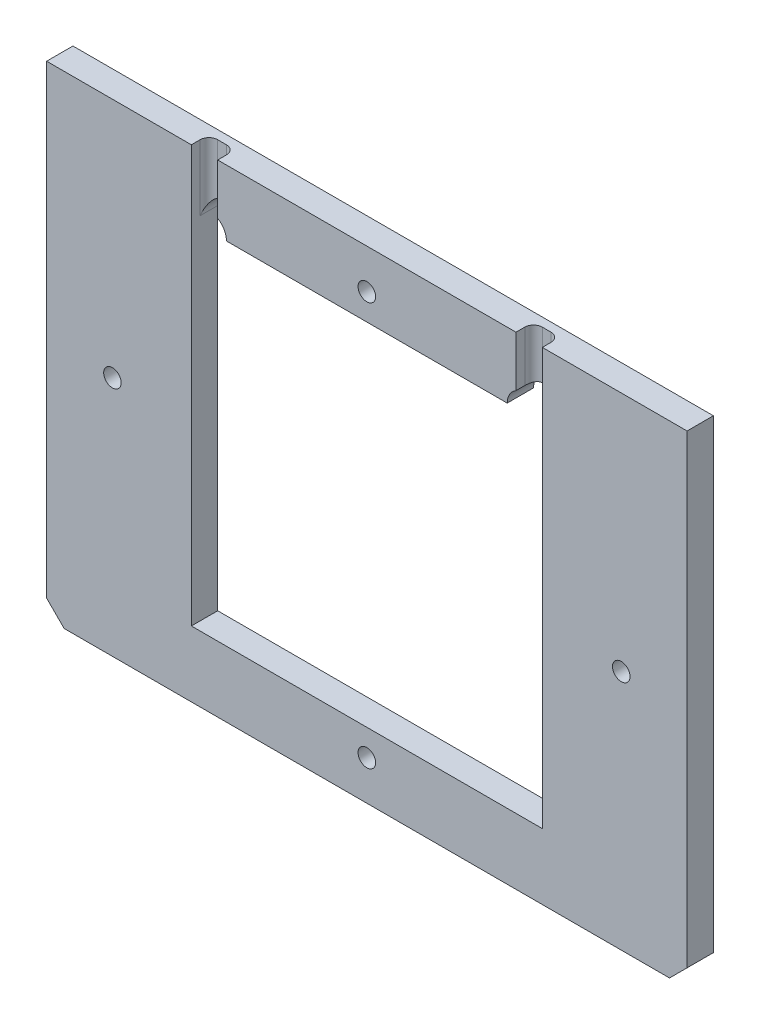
SolidWorks part; units mm, degrees
ref_plane "Face" through (0, 0, 0) normal (0, 0, 1) x (1, 0, 0)
ref_plane "Dessus" through (0, 0, 0) normal (0, 1, 0) x (1, 0, 0)
ref_plane "Droite" through (0, 0, 0) normal (1, 0, 0) x (0, 0, -1)
sketch "Esquisse1" plane through (0, 0, 0) normal (0, 0, 1) x (1, 0, 0)
  line L0 (-14.2779, 33.0997) -> (-14.2779, -21.9003) construction
  line L1 (-50.7779, 33.0997) -> (22.2221, 33.0997)
  line L2 (-50.7779, 33.0997) -> (-50.7779, -21.9003)
  line L3 (-50.7779, -21.9003) -> (22.2221, -21.9003)
  line L4 (22.2221, 33.0997) -> (22.2221, -21.9003)
  line L5 (-30.2779, 25.5997) -> (1.7221, 25.5997)
  line L6 (-34.2779, 25.5997) -> (-34.2779, -14.4003)
  line L7 (-34.2779, -14.4003) -> (5.7221, -14.4003)
  line L8 (5.7221, 25.5997) -> (5.7221, -14.4003)
  line L10 (22.2221, 5.5997) -> (-50.7779, 5.5997) construction
  circle A0 centre (-14.2779, 28.5997) radius 1
  circle A1 centre (-14.2779, -17.4003) radius 1
  arc A2 (1.7221, 25.5997) -> (5.7221, 25.5997) centre (3.7221, 25.5997) cw
  arc A4 (-34.2779, 25.5997) -> (-30.2779, 25.5997) centre (-32.2779, 25.5997) cw
  dimension "D7" = 23
  dimension "D9" = 2
  dimension "D10" = 2
  dimension "D1" = 73
  dimension "D2" = 55
  dimension "D3" = 40
  dimension "D4" = 40
  dimension "D6" = 20
  dimension "D8" = 23
extrude "Extrusion1" add sketch "Esquisse1" along normal blind 3
sketch "Esquisse2" plane through (0, 0, 3) normal (0, 0, 1) x (1, 0, 0)
  line L0 (-31.2779, 25.5997) -> (-31.2779, 33.0997)
  line L1 (22.2221, 33.0997) -> (-50.7779, 33.0997) construction
  line L2 (-31.2779, 33.0997) -> (-34.2779, 33.0997)
  line L3 (-34.2779, 33.0997) -> (-34.2779, 25.5997)
  line L4 (-34.2779, 25.5997) -> (-31.2779, 25.5997)
  line L5 (5.7221, 25.5997) -> (5.7221, 33.0997)
  line L6 (5.7221, -14.4003) -> (5.7221, 25.5997) construction
  line L7 (5.7221, 33.0997) -> (2.7221, 33.0997)
  line L8 (2.7221, 33.0997) -> (2.7221, 25.5997)
  line L9 (2.7221, 25.5997) -> (5.7221, 25.5997)
extrude "Enlèv. mat.-Extru.1" cut sketch "Esquisse2" against normal blind 2
fillet "Congé1" radius 1 4 edges at (-31.2779, 30.2157, 1) (5.7221, 29.3497, 1) (2.7221, 30.2157, 1) (-34.2779, 29.3497, 1)
sketch "Esquisse3" plane through (0, 0, 0) normal (0, 0, 1) x (1, 0, 0)
  line L0 (-50.7779, 5.5997) -> (22.2221, 5.5997) construction
  line L1 (-50.7779, 33.0997) -> (-50.7779, -21.9003) construction
  line L2 (22.2221, -21.9003) -> (22.2221, 33.0997) construction
  line L3 (-14.2779, 33.0997) -> (-14.2779, -21.9003) construction
  line L4 (2.7221, 33.0997) -> (-31.2779, 33.0997) construction
  line L5 (-50.7779, -21.9003) -> (22.2221, -21.9003) construction
  circle A0 centre (-43.2779, 5.5997) radius 1
  circle A1 centre (14.7221, 5.5997) radius 1
  dimension "D1" = 29
  dimension "D2" = 29
sketch "Esquisse4" plane through (0, 0, 0) normal (0, 0, 1) x (1, 0, 0)
  line L1 (-41.32, 4.4693) -> (-41.32, 6.73)
  line L2 (-41.32, 6.73) -> (-43.2779, 7.8604)
  line L3 (-43.2779, 7.8604) -> (-45.2358, 6.73)
  line L4 (-45.2358, 6.73) -> (-45.2358, 4.4693)
  line L5 (-45.2358, 4.4693) -> (-43.2779, 3.3389)
  line L6 (-43.2779, 3.3389) -> (-41.32, 4.4693)
  line L7 (17.0315, 5.5997) -> (15.8768, 7.5997)
  line L8 (15.8768, 7.5997) -> (13.5674, 7.5997)
  line L9 (13.5674, 7.5997) -> (12.4127, 5.5997)
  line L10 (12.4127, 5.5997) -> (13.5674, 3.5997)
  line L11 (13.5674, 3.5997) -> (15.8768, 3.5997)
  line L12 (15.8768, 3.5997) -> (17.0315, 5.5997)
  circle A0 centre (-43.2779, 5.5997) radius 1.9579 construction
  circle A1 centre (14.7221, 5.5997) radius 2 construction
extrude "Enlèv. mat.-Extru.4" cut sketch "Esquisse3" along normal through all
extrude "Enlèv. mat.-Extru.5" cut sketch "Esquisse4" along normal blind 1.5
chamfer "Chanfrein1" distance 2 angle 45 2 edges at (-50.7779, -21.9003, 1.5) (22.2221, -21.9003, 1.5)
